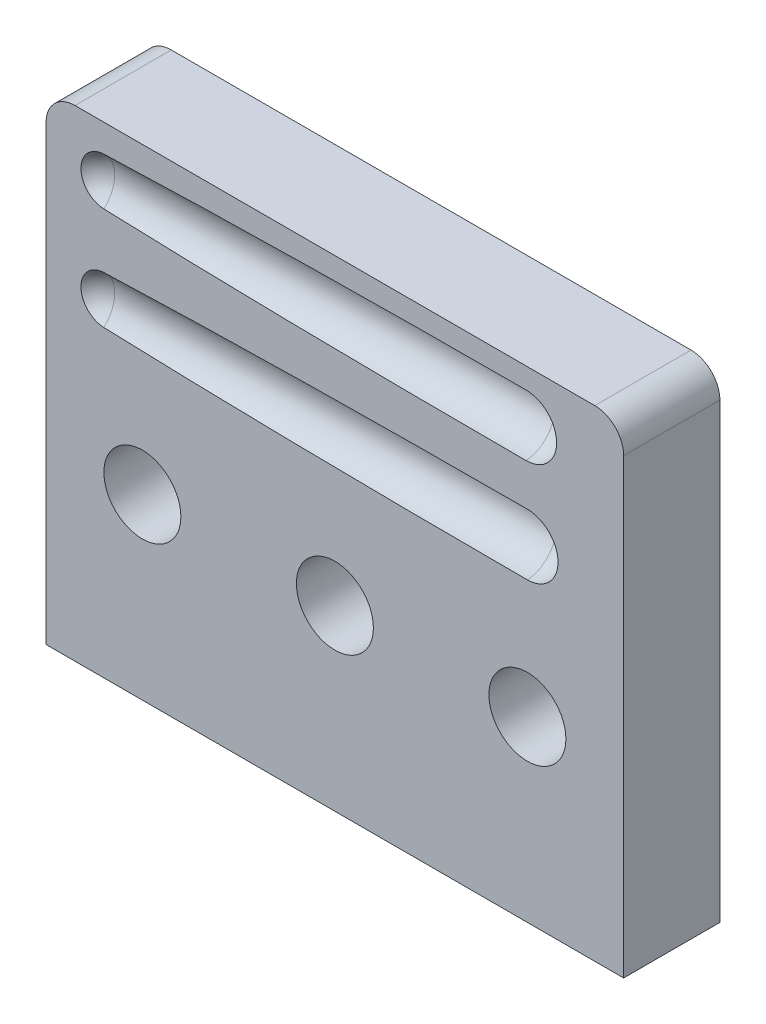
SolidWorks part; units mm, degrees
ref_plane "Plan1" through (0, 0, 0) normal (0, 0, 1) x (1, 0, 0)
ref_plane "Plan2" through (0, 0, 0) normal (0, 1, 0) x (1, 0, 0)
ref_plane "Plan3" through (0, 0, 0) normal (1, 0, 0) x (0, 0, -1)
sketch "Esquisse1" plane through (0, 0, 0) normal (0, 0, 1) x (1, 0, 0)
  line L0 (-30, -18.5) -> (30, -18.5)
  line L1 (-30, -18.5) -> (-30, 31.5)
  line L2 (30, 31.5) -> (-30, 31.5)
  line L3 (30, 31.5) -> (30, -18.5)
extrude "Base-Extrusion" add sketch "Esquisse1" along normal blind 10
fillet "Congé1" radius 3
sketch "Esquisse2" plane through (0, 0, 10) normal (0, 0, 1) x (1, 0, 0)
  circle A0 centre (-20, 0) radius 4
  circle A1 centre (0, 0) radius 4
  circle A2 centre (20, 0) radius 4
  dimension "D1" = 8
  dimension "D2" = 8
  dimension "D3" = 8
extrude "Enlèv. mat.-Extru.1" cut sketch "Esquisse2" against normal blind 10
sketch "Esquisse3" plane through (0, 0, 10) normal (0, 0, 1) x (1, 0, 0)
  line L0 (20, 22) -> (20, -14) construction
ref_plane "Plan5" through (0.4943, 0, 10.8857) normal (0.0454, 0, 0.999) x (0.999, 0, -0.0454)
sketch "Esquisse5" plane through (0, 0, 10) normal (0, 0, 1) x (1, 0, 0)
  line L0 (-24, 33) -> (-24, 5) construction
sketch "Esquisse6" plane through (0.4943, 0, 10.8857) normal (0.0454, 0, 0.999) x (0.999, 0, -0.0454)
  line L0 (-33, 26.1607) -> (36, 26.1607) construction
  line L3 (-24.4289, 33) -> (-24.4289, 5) construction
  line L4 (-24.4289, 29.3357) -> (19.3871, 29.3357)
  line L5 (22.5621, 26.1607) -> (-27.6039, 26.1607)
  arc A0 (19.3871, 29.3357) -> (22.5621, 26.1607) centre (19.3871, 26.1607) cw
  arc A1 (-24.4289, 29.3357) -> (-27.6039, 26.1607) centre (-24.4289, 26.1607) ccw
  dimension "D1" = 3.175
revolve "Enlever de la matière-Révolution1" cut sketch "Esquisse6" angle 360 about L0
sketch "Esquisse7" plane through (0.4943, 0, 10.8857) normal (0.0454, 0, 0.999) x (0.999, 0, -0.0454)
  line L0 (-34, 15.5) -> (32, 15.5) construction
  line L1 (26.5186, 31.5) -> (-27.4258, 31.5) construction
  line L2 (-24.4289, 12.32) -> (19.5258, 12.32)
  line L5 (-24.4289, 33) -> (-24.4289, 5) construction
  line L6 (19.5258, 22) -> (19.5258, -14) construction
  line L7 (22.7058, 15.5) -> (-27.6089, 15.5)
  arc A0 (19.5258, 12.32) -> (22.7058, 15.5) centre (19.5258, 15.5) ccw
  arc A1 (-24.4289, 12.32) -> (-27.6089, 15.5) centre (-24.4289, 15.5) cw
  dimension "D1" = 16
revolve "Enlever de la matière-Révolution2" cut sketch "Esquisse7" angle 360 about L0
